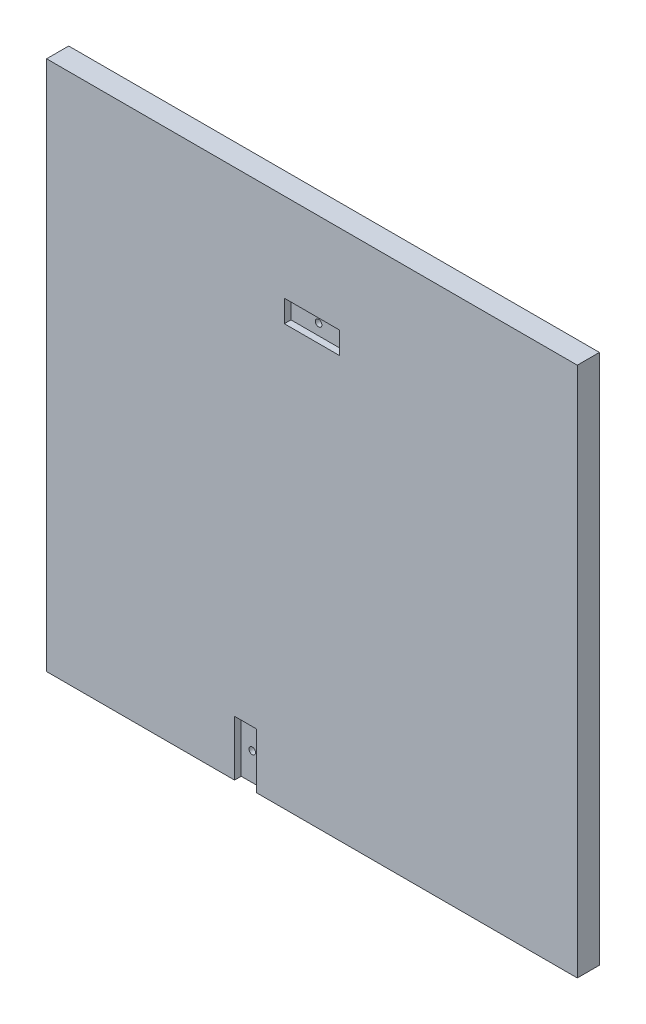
SolidWorks part; units mm, degrees
ref_plane "Plan de face" through (0, 0, 0) normal (0, 0, 1) x (1, 0, 0)
ref_plane "Plan de dessus" through (0, 0, 0) normal (0, 1, 0) x (1, 0, 0)
ref_plane "Plan de droite" through (0, 0, 0) normal (1, 0, 0) x (0, 0, -1)
sketch "Esquisse1" plane through (0, 0, 0) normal (0, 0, 1) x (1, 0, 0)
  line L1 (0, 0) -> (240, 0)
  line L2 (0, 0) -> (0, 240)
  line L3 (0, 240) -> (240, 240)
  line L4 (240, 0) -> (240, 240)
  dimension "D1" = 240
  dimension "D2" = 240
extrude "Boss.-Extru.1" add sketch "Esquisse1" along normal blind 10
sketch "Esquisse2" plane through (0, 0, 10) normal (0, 0, 1) x (1, 0, 0)
  line L0 (0, 0) -> (240, 0) construction
  line L1 (0, 240) -> (0, 0) construction
  circle A0 centre (90, 12.5) radius 1.5
  circle A1 centre (120, 195) radius 1.5
  dimension "D1" = 3
  dimension "D4" = 3
  dimension "D2" = 12.5
  dimension "D3" = 90
  dimension "D5" = 120
  dimension "D6" = 195
extrude "Enlèv. mat.-Extru.1" cut sketch "Esquisse2" against normal blind 10
sketch "Esquisse3" plane through (0, 0, 10) normal (0, 0, 1) x (1, 0, 0)
  line L0 (0, 0) -> (240, 0) construction
  line L1 (85, 25) -> (95, 25)
  line L2 (85, 25) -> (85, 0)
  line L3 (85, 0) -> (95, 0)
  line L4 (95, 25) -> (95, 0)
  line L5 (0, 240) -> (0, 0) construction
  line L7 (107.5, 200) -> (132.5, 200)
  line L8 (107.5, 200) -> (107.5, 190)
  line L9 (107.5, 190) -> (132.5, 190)
  line L10 (132.5, 200) -> (132.5, 190)
  circle A0 centre (120, 195) radius 1.5 construction
  dimension "D6" = 12.5
  dimension "D1" = 10
  dimension "D2" = 25
  dimension "D3" = 85
  dimension "D4" = 10
  dimension "D5" = 25
  dimension "D7" = 5
extrude "Enlèv. mat.-Extru.2" cut sketch "Esquisse3" against normal blind 3
